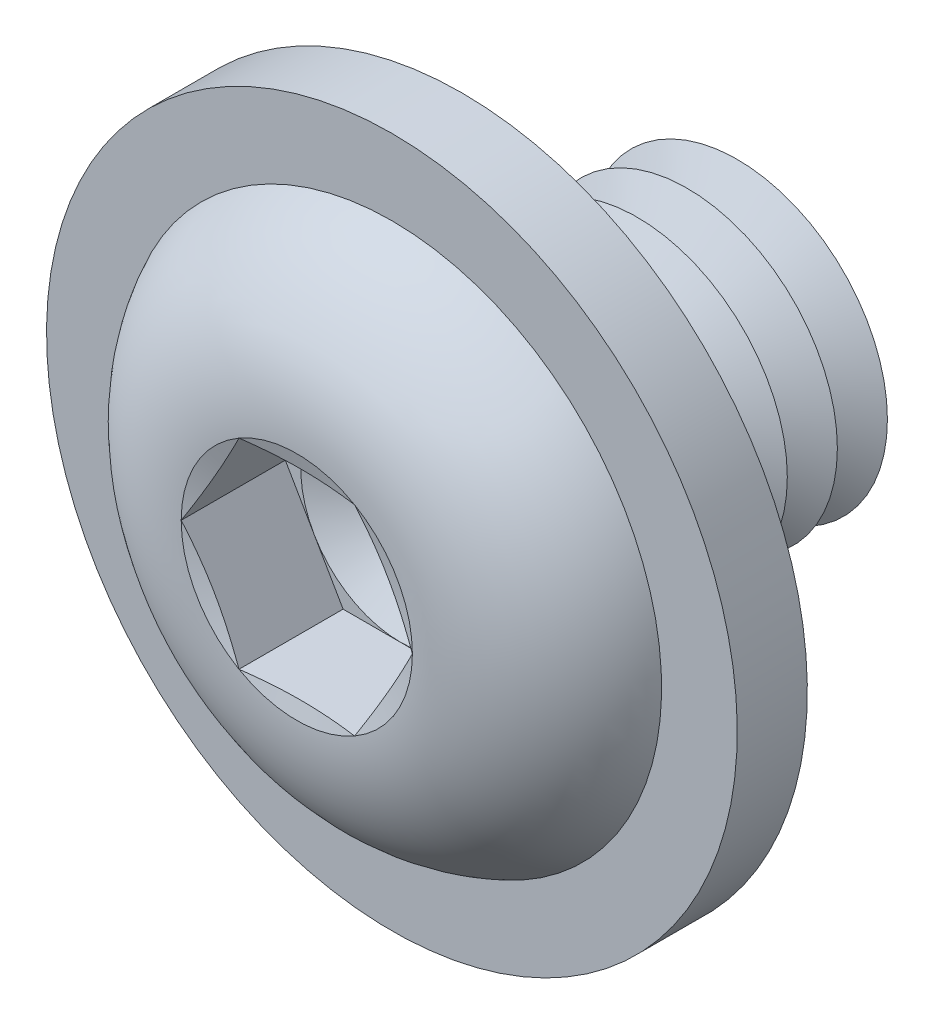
SolidWorks part; units mm, degrees
ref_plane "Front Plane" through (0, 0, 0) normal (0, 0, 1) x (1, 0, 0)
ref_plane "Top Plane" through (0, 0, 0) normal (0, 1, 0) x (1, 0, 0)
ref_plane "Right Plane" through (0, 0, 0) normal (1, 0, 0) x (0, 0, -1)
sketch "Sketch1" plane through (0, 0, 0) normal (1, 0, 0) x (0, 0, -1)
  line L0 (0, 1.5) -> (0, 2.85)
  line L3 (0, 1.5) -> (3, 1.5)
  line L4 (3, 1.5) -> (3, 0)
  line L5 (3, 0) -> (-1.65, 0) construction
  line L6 (-1.65, 0) -> (3, 0)
  line L7 (-1.65, 1.1547) -> (-1.65, 0.5773) construction
  line L8 (-1.65, 0.5773) -> (-1.65, 0)
  line L9 (-1.65, 1.1547) -> (-1.4953, 0.5773)
  line L10 (-1.4953, 0.5773) -> (-1.65, 0.5773)
  line L11 (3, 0) -> (22.7481, 0) construction
  line L12 (0, 2.85) -> (-1.65, 2.85) construction
  arc A1 (0, 2.85) -> (-1.65, 1.1547) centre (0, 1.1994) ccw
  point P8 (3, 0.75)
  dimension "D1" = 5.7
  dimension "D2" = 3
  dimension "D3" = 1.65
  dimension "D4" = 2.3094
  dimension "D5" = 3
  dimension "D6" = 15
revolve "Revolve1" add sketch "Sketch1" angle 360 about L5
fillet "Fillet1" radius 0.25 1 edges at (-1.5, 0, 0)
sketch "Sketch2" plane through (0, 0, 0) normal (1, 0, 0) x (0, 0, -1)
  line L0 (2.75, 1.5) -> (3.25, 1.5)
  line L1 (3, 1.5) -> (0.25, 1.5) construction
  line L2 (3.25, 1.5) -> (3, 1.067)
  line L3 (3, -1.5) -> (3, 1.5) construction
  line L4 (3, 1.067) -> (2.75, 1.5)
  dimension "D1" = 0.5
revolve "Cut-Revolve1" cut sketch "Sketch2" angle 360 about axis through (0, 0, -3) along (0, 0, -1)
pattern_linear "LPattern1" count 6 spacing 0.5 along (0, 0, 1) of "Cut-Revolve1"
sketch "Sketch3" plane through (0, 0, 1.65) normal (0, 0, 1) x (1, 0, 0)
  line L7 (0.5773, 1) -> (-0.5774, 1)
  line L8 (-0.5774, 1) -> (-1.1547, 0)
  line L9 (-1.1547, 0) -> (-0.5773, -1)
  line L10 (-0.5773, -1) -> (0.5773, -1)
  line L11 (0.5773, -1) -> (1.1547, 0)
  line L12 (1.1547, 0) -> (0.5773, 1)
  circle A0 centre (0, 0) radius 1 construction
  circle A3 centre (0, 0) radius 1.1547 construction
extrude "Cut-Extrude1" cut sketch "Sketch3" against normal blind 1.04
sketch "Sketch4" plane through (0, 0, 0.61) normal (0, 0, 1) x (1, 0, 0)
  line L1 (0.5773, 1) -> (-0.5774, 1) construction
  circle A0 centre (0, 0) radius 1
extrude "Cut-Extrude2" cut sketch "Sketch4" against normal through all draft 60
sketch "Sketch5" plane through (0, 0, 0) normal (0, 0, -1) x (-1, 0, 0)
  circle A0 centre (0, 0) radius 3.45
  circle A1 centre (0, 0) radius 1.75
  circle A2 centre (0, 0) radius 1.75 construction
  dimension "D1" = 6.9
extrude "Boss-Extrude1" add sketch "Sketch5" against normal blind 0.7
